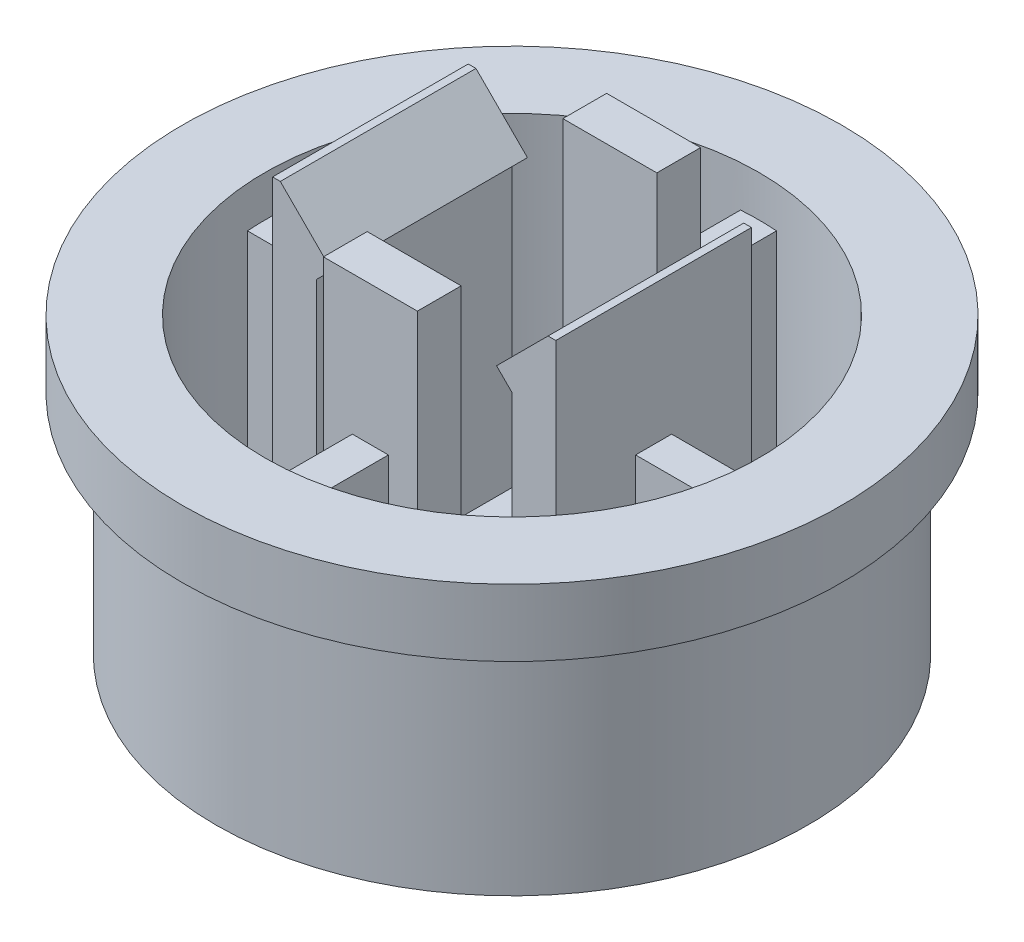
SolidWorks part; units mm, degrees
ref_plane "Спереди" through (0, 0, 0) normal (0, 0, 1) x (1, 0, 0)
ref_plane "Сверху" through (0, 0, 0) normal (0, 1, 0) x (1, 0, 0)
ref_plane "Справа" through (0, 0, 0) normal (1, 0, 0) x (0, 0, -1)
sketch "Эскиз1" plane through (0, 0, 0) normal (0, 1, 0) x (1, 0, 0)
  circle A0 centre (0, 0) radius 5.75
extrude "Бобышка-Вытянуть1" add sketch "Эскиз1" along normal blind 0.9
sketch "Эскиз2" plane through (0, 0.9, 0) normal (0, 1, 0) x (1, 0, 0)
  circle A0 centre (0, 0) radius 5.75
  circle A1 centre (0, 0) radius 4.8
extrude "Бобышка-Вытянуть2" add sketch "Эскиз2" along normal blind 3.5
sketch "Эскиз3" plane through (0, 4.4, 0) normal (0, 1, 0) x (1, 0, 0)
  circle A0 centre (0, 0) radius 4.8
  circle A1 centre (0, 0) radius 6.4
extrude "Бобышка-Вытянуть3" add sketch "Эскиз3" along normal blind 1.3
sketch "Эскиз4" plane through (0, 0.9, 0) normal (0, 1, 0) x (1, 0, 0)
  line L2 (-2.75, -1.9) -> (-2.75, 1.9)
  line L4 (2.75, -1.9) -> (2.75, 1.9)
  line L8 (-1.9, -1.9) -> (-1.9, 1.9)
  line L10 (1.9, -1.9) -> (1.9, 1.9)
  line L11 (-0.9124, 1.9) -> (0.9124, 1.9)
  line L12 (-0.9124, 1.9) -> (-0.9124, 2.75)
  line L13 (-0.9124, 2.75) -> (0.9124, 2.75)
  line L14 (0.9124, 1.9) -> (0.9124, 2.75)
  line L15 (-0.9124, 1.9) -> (0.9124, 2.75) construction
  line L16 (-0.9124, 2.75) -> (0.9124, 1.9) construction
  line L17 (-1.9, 1.9) -> (-2.75, 1.9)
  line L18 (-0.9124, -2.75) -> (0.9124, -2.75)
  line L19 (-0.9124, -2.75) -> (-0.9124, -1.9)
  line L20 (-0.9124, -1.9) -> (0.9124, -1.9)
  line L21 (0.9124, -2.75) -> (0.9124, -1.9)
  line L22 (-0.9124, -2.75) -> (0.9124, -1.9) construction
  line L23 (-0.9124, -1.9) -> (0.9124, -2.75) construction
  line L24 (1.9, 1.9) -> (2.75, 1.9)
  line L25 (-1.9, -1.9) -> (-2.75, -1.9)
  line L26 (1.9, -1.9) -> (2.75, -1.9)
  point P0 (0, 0)
  point P6 (0, 0)
  point P15 (0, 2.325)
  point P22 (0, -2.325)
  dimension "D3" = 3.8
extrude "Бобышка-Вытянуть4" add sketch "Эскиз4" along normal blind 6.7
sketch "Эскиз5" plane through (0, 0, -1.9) normal (0, 0, -1) x (-1, 0, 0)
  line L9 (1.9, 7.6) -> (1.9, 0.9) construction
  line L10 (-1.9, 7.6) -> (-1.9, 0.9) construction
  line L11 (1.9, 6.3) -> (1.6, 6.6)
  line L12 (1.6, 6.6) -> (2.6, 7.6)
  line L13 (1.9, 7.6) -> (2.75, 7.6) construction
  line L14 (-1.9, 6.3) -> (-1.6, 6.6)
  line L15 (-1.6, 6.6) -> (-2.6, 7.6)
  line L16 (-2.75, 7.6) -> (-1.9, 7.6) construction
  line L17 (1.9, 6.3) -> (2.6, 7.6)
  line L18 (-1.9, 6.3) -> (-2.6, 7.6)
extrude "Бобышка-Вытянуть5" add sketch "Эскиз5" against normal blind 3.8
sketch "Эскиз6" plane through (0, 0, -1.9) normal (0, 0, -1) x (-1, 0, 0)
  line L0 (1.9, 6.9) -> (2.6, 7.6)
  line L1 (1.9, 7.6) -> (2.75, 7.6) construction
  line L2 (2.6, 7.6) -> (1.9, 7.6)
  line L3 (1.9, 7.6) -> (1.9, 6.9)
  line L4 (-1.9, 6.9) -> (-2.6, 7.6)
  line L5 (-2.75, 7.6) -> (-1.9, 7.6) construction
  line L6 (-2.6, 7.6) -> (-1.9, 7.6)
  line L7 (-1.9, 7.6) -> (-1.9, 6.9)
extrude "Вырез-Вытянуть1" cut sketch "Эскиз6" against normal up to next
sketch "Эскиз7" plane through (0, 0.9, 0) normal (0, 1, 0) x (1, 0, 0)
  line L0 (-0.35, -2.75) -> (0.35, -2.75)
  line L1 (4.7872, -0.35) -> (2.75, -0.35)
  line L2 (0.35, 2.75) -> (0.35, 4.7872)
  line L3 (4.7872, 0.35) -> (2.75, 0.35)
  line L4 (-0.35, 2.75) -> (-0.35, 4.7872)
  line L5 (-0.9124, -2.75) -> (0.9124, -2.75) construction
  line L6 (-0.9124, -2.75) -> (0.9124, -2.75) construction
  line L7 (-2.75, -0.35) -> (-4.7872, -0.35)
  line L8 (0.35, -4.7872) -> (0.35, -2.75)
  line L9 (-2.75, 0.35) -> (-4.7872, 0.35)
  line L10 (-0.35, -4.7872) -> (-0.35, -2.75)
  line L11 (-2.75, -0.35) -> (-2.75, 0.35)
  line L12 (-2.75, 1.9) -> (-2.75, -1.9) construction
  line L13 (-0.35, 2.75) -> (0.35, 2.75)
  line L14 (0.9124, 2.75) -> (-0.9124, 2.75) construction
  line L15 (2.75, -0.35) -> (2.75, 0.35)
  line L16 (2.75, -1.9) -> (2.75, 1.9) construction
  arc A0 (-0.35, -4.7872) -> (0.35, -4.7872) centre (0, 0) ccw
  arc A1 (-4.7872, 0.35) -> (-4.7872, -0.35) centre (0, 0) ccw
  arc A2 (0.35, 4.7872) -> (-0.35, 4.7872) centre (0, 0) ccw
  arc A3 (4.7872, -0.35) -> (4.7872, 0.35) centre (0, 0) ccw
extrude "Бобышка-Вытянуть6" add sketch "Эскиз7" along normal blind 4
